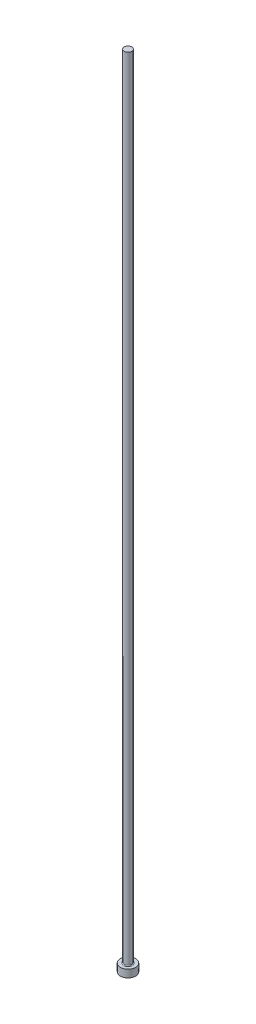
SolidWorks part; units mm, degrees
ref_plane "Plano frontal" through (0, 0, 0) normal (0, 0, 1) x (1, 0, 0)
ref_plane "Plano superior" through (0, 0, 0) normal (0, 1, 0) x (1, 0, 0)
ref_plane "Plano direito" through (0, 0, 0) normal (1, 0, 0) x (0, 0, -1)
sketch "Esboço1" plane through (0, 0, 0) normal (0, 0, 1) x (1, 0, 0)
  line L0 (0, 0) -> (3, 0)
  line L1 (3, 0) -> (3, 3)
  line L2 (3, 3) -> (1.8, 3)
  line L3 (1.5, 3.3) -> (1.5, 315)
  line L4 (1.5, 315) -> (0, 315)
  line L5 (0, 315) -> (0, 0) construction
  line L6 (0, 0) -> (0, 315)
  arc A0 (1.8, 3) -> (1.5, 3.3) centre (1.8, 3.3) cw
  dimension "D3" = 0.3
  dimension "D1" = 6
  dimension "D2" = 3
  dimension "D4" = 3
  dimension "D5" = 315
revolve "Revolução1" add sketch "Esboço1" angle 360 about L5
sketch "Esboço2"
  dimension "D1" = 1.6125
  dimension "D2" = 0.3375
  dimension "D3" = 0.525
  dimension "D4" = 0.225
wrap "Envolver1" sketch "Esboço2" wrap type deboss source sketch "Esboço2" thickness 0.1 parameters "D1"=0.1
